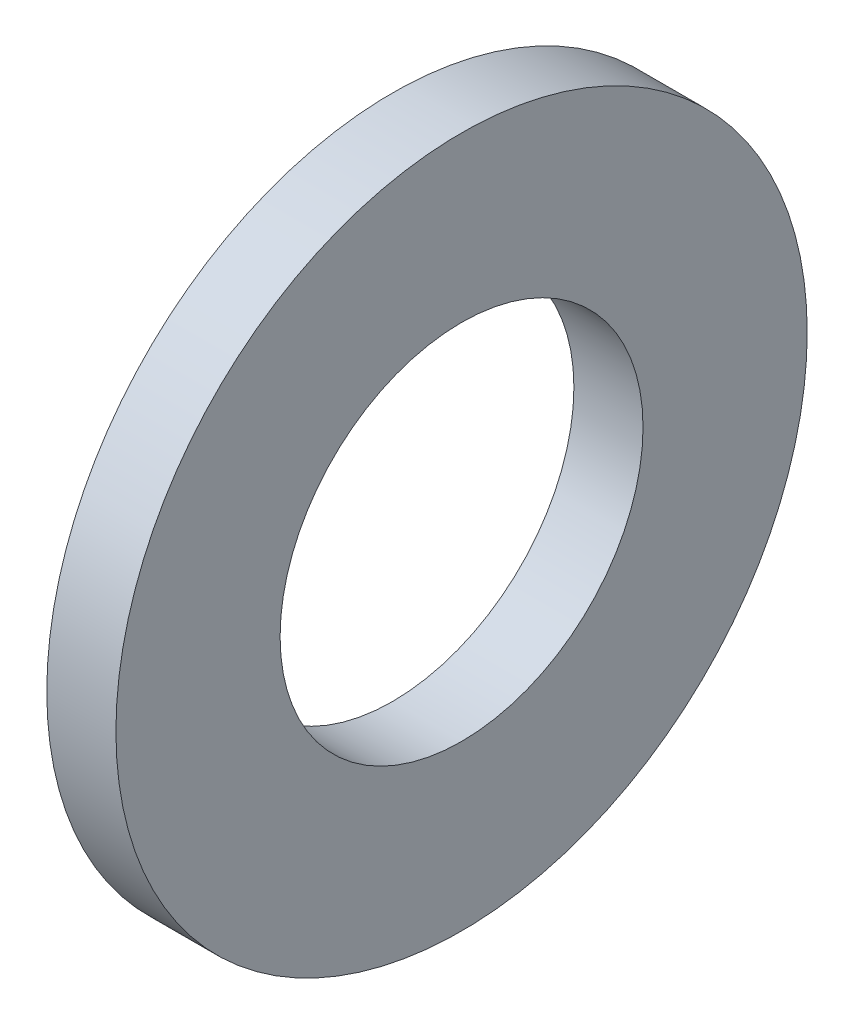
SolidWorks part; units mm, degrees
ref_plane "Plane1" through (0, 0, 0) normal (0, 0, 1) x (1, 0, 0)
ref_plane "Plane2" through (0, 0, 0) normal (0, 1, 0) x (1, 0, 0)
ref_plane "Plane3" through (0, 0, 0) normal (1, 0, 0) x (0, 0, -1)
revolve "Base-Revolve" add sketch "Sketch1" angle 360 about L0
sketch "Sketch1" plane through (0, 0, 0) normal (0, 0, 1) x (1, 0, 0)
  line L0 (-34.925, 0) -> (9.525, 0) construction
  line L1 (0, 4.2) -> (0, 8)
  line L2 (0, 8) -> (-1.6, 8)
  line L3 (-1.6, 8) -> (-1.6, 4.2)
  line L4 (-1.6, 4.2) -> (0, 4.2)
  dimension "Thickness" = 1.6
  dimension "Inside_dia" = 8.4
  dimension "Outside_dia" = 16
